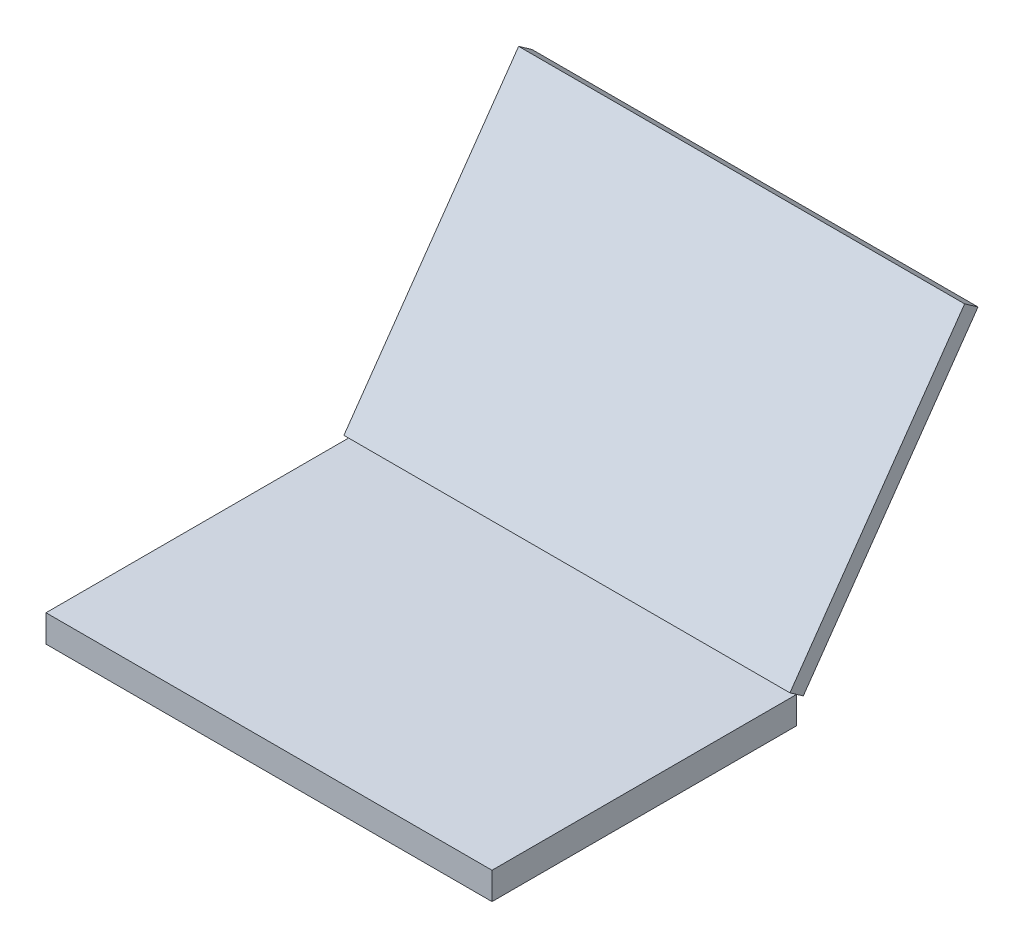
SolidWorks part; units mm, degrees
ref_plane "Plan de face" through (0, 0, 0) normal (0, 0, 1) x (1, 0, 0)
ref_plane "Plan de dessus" through (0, 0, 0) normal (0, 1, 0) x (1, 0, 0)
ref_plane "Plan de droite" through (0, 0, 0) normal (1, 0, 0) x (0, 0, -1)
sketch "Esquisse1" plane through (0, 0, 0) normal (0, 1, 0) x (1, 0, 0)
  line L1 (-205, -140) -> (205, -140)
  line L2 (-205, -140) -> (-205, 140)
  line L3 (-205, 140) -> (205, 140)
  line L4 (205, -140) -> (205, 140)
  line L5 (-205, -140) -> (205, 140) construction
  line L6 (-205, 140) -> (205, -140) construction
  point P0 (0, 0)
  dimension "D1" = 410
  dimension "D2" = 280
extrude "Boss.-Extru.1" add sketch "Esquisse1" along normal mid plane 25
ref_plane "Plan1" through (0, -61.6661, -88.0683) normal (0, -0.5736, -0.8192) x (1, 0, 0)
sketch "Esquisse2" plane through (0, -61.6661, -88.0683) normal (0, -0.5736, -0.8192) x (1, 0, 0)
  line L0 (205, 70.0613) -> (205, -90.5401) construction
  line L1 (-205, -90.5401) -> (205, -90.5401)
  line L2 (-205, -90.5401) -> (-205, -370.5401)
  line L3 (-205, -370.5401) -> (205, -370.5401)
  line L4 (205, -90.5401) -> (205, -370.5401)
  dimension "D1" = 280
extrude "Boss.-Extru.2" add sketch "Esquisse2" along normal mid plane 15 separate body
